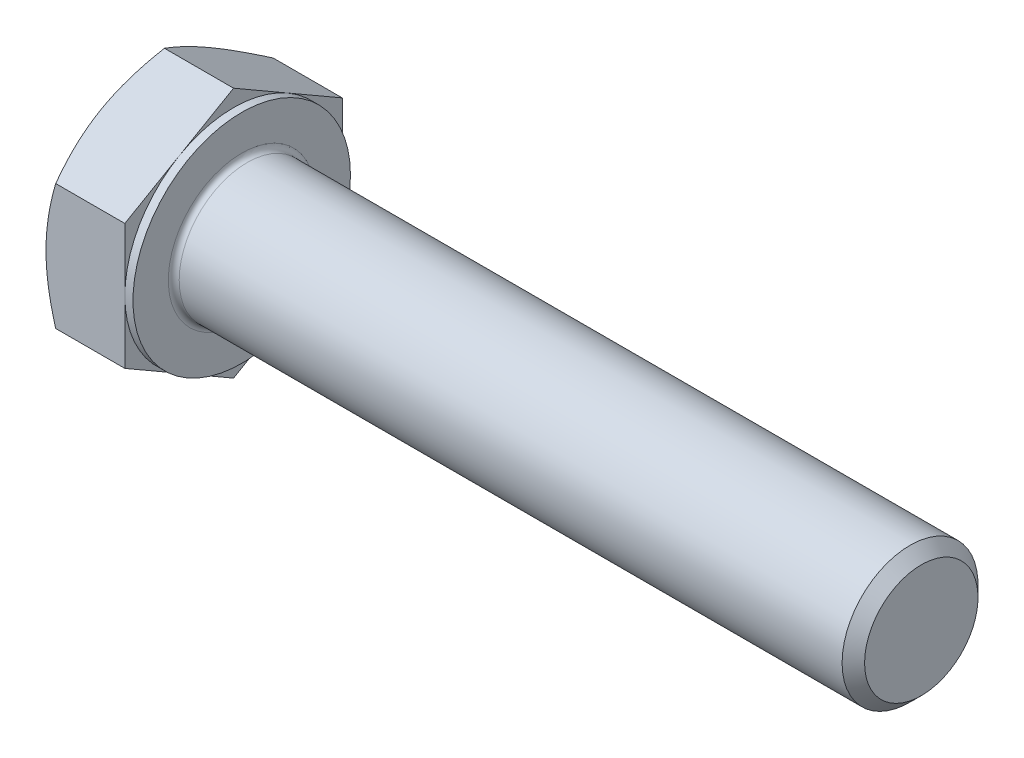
SolidWorks part; units mm, degrees
ref_plane "Plane1" through (0, 0, 0) normal (0, 0, 1) x (1, 0, 0)
ref_plane "Plane2" through (0, 0, 0) normal (0, 1, 0) x (1, 0, 0)
ref_plane "Plane3" through (0, 0, 0) normal (1, 0, 0) x (0, 0, -1)
sketch "Sketch1" plane through (0, 0, 0) normal (1, 0, 0) x (0, 0, -1)
  line L0 (8, 4.6188) -> (8, -4.6188)
  line L1 (-8, 4.6188) -> (-8, -4.6188)
  line L2 (8, -4.6188) -> (0, -9.2376)
  line L3 (0, -9.2376) -> (-8, -4.6188)
  line L4 (8, 4.6188) -> (0, 9.2376)
  line L5 (0, 9.2376) -> (-8, 4.6188)
  dimension "Width_flats" = 16
  dimension "D2" = 120
  dimension "D3" = 8
  dimension "D4" = 8
  dimension "D5" = 8
extrude "BaseHead" add sketch "Sketch1" along normal blind 6.4
sketch "BodySke" plane through (0, 0, 0) normal (0, 0, 1) x (1, 0, 0)
  line L0 (0, 4.6188) -> (0, -4.6188) construction
  line L1 (0, 0) -> (56.4, 0)
  line L2 (0, 0) -> (0, 5)
  line L3 (0, 5) -> (55.572, 5)
  line L4 (56.4, 0) -> (56.4, 4.172)
  line L5 (6.4, 9.2376) -> (6.4, 4.6188) construction
  line L6 (56.4, 4.172) -> (55.572, 5)
  line L7 (0, 0) -> (96.52, 0) construction
  line L8 (56.4, -4.172) -> (55.572, -5) construction
  line L9 (0, -5) -> (55.572, -5) construction
  line L10 (7.9, 15.24) -> (7.9, -1.27) construction
  line L11 (30.4, 15.24) -> (30.4, -1.27) construction
  line L12 (6.4, 4.6188) -> (6.4, -4.6188) construction
  dimension "Length" = 50
  dimension "Body_ch_ang" = 45
  dimension "Diameter" = 10
  dimension "Minor_dia" = 8.344
  dimension "Advance" = 1.5
  dimension "Thread_nom" = 26
revolve "BaseBody" add sketch "BodySke"
fillet "HeadFillet" radius 0.4 1 edges at (6.4, 0, -5)
sketch "Sketch3" plane through (0, 0, 0) normal (0, 0, 1) x (1, 0, 0)
  line L0 (0, 8) -> (3.6013, 14.2376)
  line L1 (0, 9.2376) -> (0, 4.6188) construction
  line L2 (3.6013, 14.2376) -> (3.6013, 19.2376)
  line L3 (3.6013, 19.2376) -> (-10, 19.2376)
  line L4 (-10, 19.2376) -> (-10, 8)
  line L5 (-10, 8) -> (0, 8)
  line L6 (0, 0) -> (99.06, 0) construction
  line L7 (6.4, 9.2376) -> (0, 9.2376) construction
  dimension "D1" = 8
  dimension "D2" = 5
  dimension "D3" = 10
  dimension "D4" = 5
  dimension "Head_ch_ang" = 30
revolve "HeadChamfer" cut sketch "Sketch3" angle 360 about L6
sketch "Sketch4" plane through (0, 0, 0) normal (0, 0, 1) x (1, 0, 0)
  line L1 (6.4, 9.2376) -> (6.4, 4.6188) construction
  line L2 (6.4, 8) -> (5.8, 8)
  line L3 (6.4, 8) -> (6.4, 19.2376)
  line L4 (6.4, 19.2376) -> (5.8, 19.2376)
  line L5 (0, 0) -> (95.25, 0) construction
  line L6 (0, 0) -> (96.52, 0) construction
  line L7 (5.8, 8) -> (5.8, 19.2376)
  line L8 (6.4, 9.2376) -> (0.7145, 9.2376) construction
  dimension "D1" = 16
  dimension "D2" = 10
  dimension "Bearing_ht" = 0.6
revolve "BearingFace" cut sketch "Sketch4" angle 360 about L5
sketch "ThdSchSke" plane through (0, 0, 0) normal (0, 0, 1) x (1, 0, 0)
  line L0 (30.4, -4.172) -> (29.8202, -5)
  line L1 (30.4, -4.172) -> (30.9798, -5)
  line L2 (30.9798, -5) -> (30.9798, -6.25)
  line L3 (-3.175, 0) -> (5.1513, 0) construction
  line L5 (30.9798, -6.25) -> (29.8202, -6.25)
  line L6 (29.8202, -6.25) -> (29.8202, -5)
  dimension "Thread_minor" = 8.344
  dimension "Diameter" = 10
  dimension "Start" = 30.4
  dimension "SideAngle" = 55
  dimension "VeeAngle" = 70
  dimension "Overcut" = 12.5
revolve "ThreadSchematic" [suppressed] cut sketch "ThdSchSke" angle 360 about L3
pattern_linear "ThdSchPat" [suppressed]
equation "\"D3@Sketch1\" = \"Width_flats@Sketch1\" / 2"
equation "\"D4@Sketch1\" = \"D3@Sketch1\""
equation "\"D5@Sketch1\" = \"D4@Sketch1\""
equation "\"Thread_minor@ThreadCosmetic\" = \"Minor_dia@BodySke\""
equation "\"D1@Sketch3\" = \"Width_flats@Sketch1\" / 2"
equation "\"D1@Sketch4\" = \"Width_flats@Sketch1\""
equation "\"Thread_length@ThreadCosmetic\" = ((sgn( (\"Length@BodySke\" - \"Advance@BodySke\" ) - \"Thread_nom@BodySke\" )-1)*( (\"Length@BodySke\" - \"Advance@BodySke\" ) - \"Thread_nom@BodySke\" ))/-2+ \"Thread_nom@BodySke\""
equation "\"Thread_minor@ThdSchSke\" = \"Minor_dia@BodySke\""
equation "\"Diameter@ThdSchSke\" = \"Diameter@BodySke\""
equation "\"Overcut@ThdSchSke\" = \"Diameter@BodySke\" * 1.25"
equation "\"Start@ThdSchSke\" = \"Head_ht@BaseHead\" + \"Length@BodySke\" - \"Thread_length@ThreadCosmetic\"  '---Non-countersunk---"
equation "\"Num_threads@ThdSchPat\" = int( \"Thread_length@ThreadCosmetic\" / \"Advance@BodySke\" + 0.999 )  + 1"
equation "\"Advance@ThdSchPat\" = \"Thread_length@ThreadCosmetic\" /  (\"Num_threads@ThdSchPat\" - 1) 'relax it"
equation "\"Num_threads@ThdSchPat\" = \"Num_threads@ThdSchPat\" - sgn( \"Num_threads@ThdSchPat\" - 1) '---chamfered tips only---"
